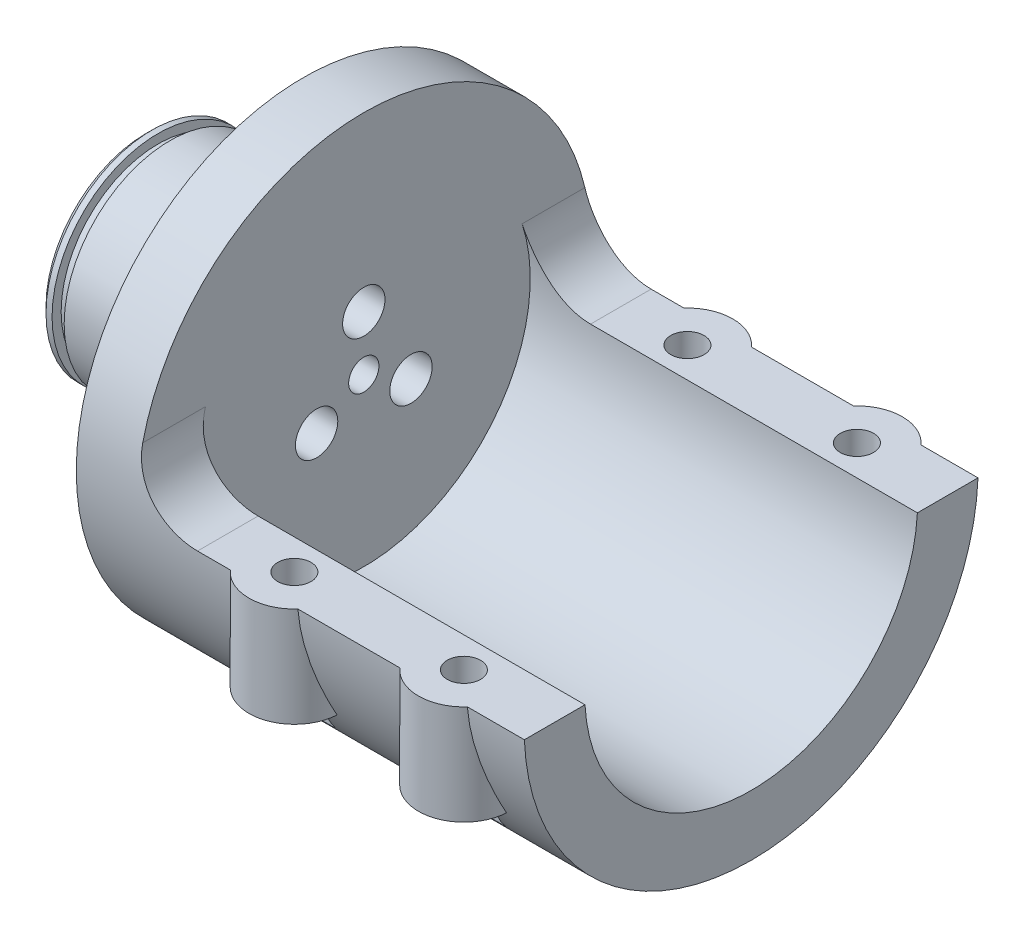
SolidWorks part; units mm, degrees
ref_plane "Face" through (0, 0, 0) normal (0, 0, 1) x (1, 0, 0)
ref_plane "Dessus" through (0, 0, 0) normal (0, 1, 0) x (1, 0, 0)
ref_plane "Droite" through (0, 0, 0) normal (1, 0, 0) x (0, 0, -1)
sketch "Esquisse1" plane through (0, 0, 0) normal (0, 0, 1) x (1, 0, 0)
  line L0 (0, 0) -> (130.2531, 0) construction
  line L1 (0, 16.5) -> (0, 2.5)
  line L2 (18, 17.5) -> (4, 17.5)
  line L3 (18, 23.9708) -> (18, 17.5)
  line L4 (26, 31.9708) -> (26, 37.5)
  line L5 (26, 37.5) -> (100, 37.5)
  line L6 (100, 37.5) -> (100, 27.5)
  line L7 (100, 27.5) -> (36, 27.5)
  line L8 (36, 27.5) -> (36, 2.5)
  line L9 (2, 17.5) -> (2, 16)
  line L10 (2, 16) -> (4, 16)
  line L11 (4, 16) -> (4, 17.5)
  line L12 (2, 17.5) -> (1, 17.5)
  line L13 (1, 17.5) -> (0, 16.5)
  line L14 (36, 2.5) -> (0, 2.5)
  arc A0 (18, 23.9708) -> (26, 31.9708) centre (18, 31.9708) ccw
  dimension "D3" = 8
  dimension "D1" = 35
  dimension "D2" = 18
  dimension "D4" = 75
  dimension "D5" = 55
  dimension "D6" = 8
  dimension "D7" = 74
  dimension "D8" = 14
  dimension "D9" = 2
  dimension "D10" = 45
  dimension "D11" = 32
  dimension "D12" = 10
  dimension "D13" = 5
revolve "Révolution1" add sketch "Esquisse1" angle 360 about L0
sketch "Esquisse2" plane through (0, 0, 0) normal (0, 0, 1) x (1, 0, 0)
  line L0 (36, 40.8684) -> (36, 8.5)
  line L1 (46, -1.5) -> (100, -1.5)
  line L2 (100, -37.5) -> (100, 37.5) construction
  line L3 (26, 37.5) -> (26, -37.5) construction
  line L4 (36, 40.8684) -> (100, 40.8684)
  line L6 (26, -37.5) -> (100, -37.5) construction
  line L9 (100, 40.8684) -> (100, -1.5)
  arc A0 (36, 8.5) -> (46, -1.5) centre (46, 8.5) ccw
  dimension "D3" = 10
  dimension "D1" = 10
  dimension "D2" = 36
extrude "Enlèv. mat.-Extru.1" cut sketch "Esquisse2" against normal through all and the other way through all
sketch "Esquisse3" plane through (0, -1.5, 0) normal (0, 1, 0) x (-1, 0, 0)
  line L0 (-100, 32.4645) -> (-66.2059, 32.4645) construction
  line L1 (-100, 27.4591) -> (-100, 37.47) construction
  line L2 (-91.7004, 29.0948) -> (-78.2996, 29.0948)
  line L3 (-63.7004, 29.0948) -> (-50.2996, 29.0948)
  line L4 (-47.2008, 0) -> (-85, 0) construction
  line L5 (-63.7004, -29.0948) -> (-50.2996, -29.0948)
  line L6 (-91.7004, -29.0948) -> (-78.2996, -29.0948)
  arc A0 (-78.2996, 29.0948) -> (-91.7004, 29.0948) centre (-85, 32.4645) ccw
  arc A1 (-50.2996, 29.0948) -> (-63.7004, 29.0948) centre (-57, 32.4645) ccw
  arc A2 (-50.2996, -29.0948) -> (-63.7004, -29.0948) centre (-57, -32.4645) cw
  arc A3 (-78.2996, -29.0948) -> (-91.7004, -29.0948) centre (-85, -32.4645) cw
  dimension "D1" = 15
  dimension "D2" = 15
extrude "Extrusion1" add sketch "Esquisse3" against normal blind 16.5
sketch "Esquisse4" plane through (0, -18, 0) normal (0, -1, 0) x (1, 0, 0)
  line L0 (77.5125, -32.8976) -> (92.4875, -32.8976) construction
  line L1 (82.6329, -36.5645) -> (87.3671, -36.5645)
  line L2 (87.3671, -36.5645) -> (89.7343, -32.4645)
  line L3 (89.7343, -32.4645) -> (87.3671, -28.3645)
  line L4 (87.3671, -28.3645) -> (82.6329, -28.3645)
  line L5 (82.6329, -28.3645) -> (80.2657, -32.4645)
  line L6 (80.2657, -32.4645) -> (82.6329, -36.5645)
  line L7 (54.6329, -36.5645) -> (59.3671, -36.5645)
  line L8 (59.3671, -36.5645) -> (61.7343, -32.4645)
  line L9 (61.7343, -32.4645) -> (59.3671, -28.3645)
  line L10 (59.3671, -28.3645) -> (54.6329, -28.3645)
  line L11 (54.6329, -28.3645) -> (52.2657, -32.4645)
  line L12 (52.2657, -32.4645) -> (54.6329, -36.5645)
  line L13 (0, 0) -> (36.4459, 0) construction
  line L14 (52.2657, 32.4645) -> (54.6329, 36.5645)
  line L15 (54.6329, 28.3645) -> (52.2657, 32.4645)
  line L16 (59.3671, 28.3645) -> (54.6329, 28.3645)
  line L17 (61.7343, 32.4645) -> (59.3671, 28.3645)
  line L18 (59.3671, 36.5645) -> (61.7343, 32.4645)
  line L19 (54.6329, 36.5645) -> (59.3671, 36.5645)
  line L20 (80.2657, 32.4645) -> (82.6329, 36.5645)
  line L21 (82.6329, 28.3645) -> (80.2657, 32.4645)
  line L22 (87.3671, 28.3645) -> (82.6329, 28.3645)
  line L23 (89.7343, 32.4645) -> (87.3671, 28.3645)
  line L24 (87.3671, 36.5645) -> (89.7343, 32.4645)
  line L25 (82.6329, 36.5645) -> (87.3671, 36.5645)
  circle A0 centre (85, -32.4645) radius 4.1 construction
  circle A1 centre (57, -32.4645) radius 4.1 construction
  circle A2 centre (57, 32.4645) radius 4.1 construction
  circle A3 centre (85, 32.4645) radius 4.1 construction
  dimension "D1" = 8.2
extrude "Enlèv. mat.-Extru.2" cut sketch "Esquisse4" against normal blind 6 and the other way through all draft 2
sketch "Esquisse5" plane through (0, -1.5, 0) normal (0, 1, 0) x (-1, 0, 0)
  line L0 (0, 0) -> (-45.8187, 0) construction
  circle A0 centre (-85, -32.4645) radius 2.75
  circle A1 centre (-57, -32.4645) radius 2.75
  circle A2 centre (-57, 32.4645) radius 2.75
  circle A3 centre (-85, 32.4645) radius 2.75
  dimension "D1" = 5.5
extrude "Enlèv. mat.-Extru.3" cut sketch "Esquisse5" against normal through all
sketch "Esquisse6" plane through (36, 0, 0) normal (1, 0, 0) x (0, 0, -1)
  circle A0 centre (0, 9) radius 3.5
  circle A1 centre (0, 0) radius 2.5 construction
  circle A2 centre (7.7942, -4.5) radius 3.5
  circle A3 centre (-7.7942, -4.5) radius 3.5
  dimension "D1" = 7
  dimension "D2" = 9
extrude "Enlèv. mat.-Extru.4" cut sketch "Esquisse6" against normal through all
chamfer "Chanfrein1" distance 1 angle 45
